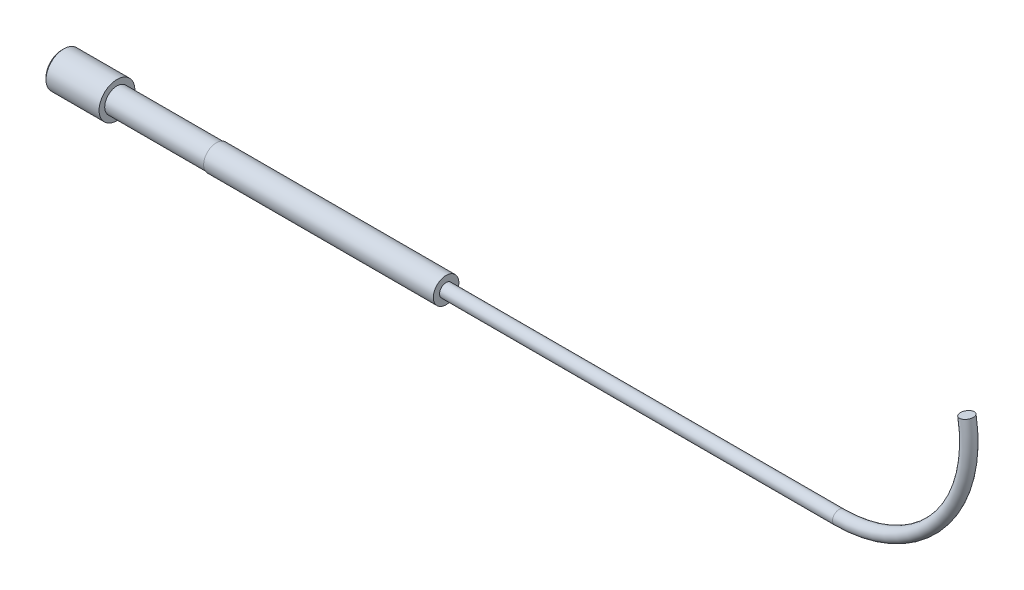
SolidWorks part; units mm, degrees
ref_plane "Front Plane" through (0, 0, 0) normal (0, 0, 1) x (1, 0, 0)
ref_plane "Top Plane" through (0, 0, 0) normal (0, 1, 0) x (1, 0, 0)
ref_plane "Right Plane" through (0, 0, 0) normal (1, 0, 0) x (0, 0, -1)
sketch "Sketch1" plane through (0, 0, 0) normal (0, 0, 1) x (1, 0, 0)
  line L0 (0, 0) -> (52.5031, 0) construction
  line L1 (0, 0) -> (0, 2.2225) construction
  line L2 (0, 2.2225) -> (6.858, 2.2225)
  line L3 (6.858, 2.2225) -> (6.858, 1.524)
  line L4 (6.858, 1.524) -> (19.2278, 1.524)
  line L5 (19.2278, 1.524) -> (19.2278, 1.5875)
  line L6 (19.2278, 1.5875) -> (47.8028, 1.5875)
  line L7 (47.8028, 1.5875) -> (47.8028, 0)
  line L8 (1.27, 0) -> (47.8028, 0)
  line L9 (0, 2.2225) -> (0, 1.651)
  line L10 (0, 1.651) -> (4.7625, 1.651)
  line L11 (4.7625, 1.651) -> (4.7625, 0.254)
  line L12 (4.7625, 0.254) -> (1.27, 0.254)
  line L13 (1.27, 0.254) -> (1.27, 0)
  dimension "D1" = 4.445
  dimension "D2" = 6.858
  dimension "D3" = 19.2278
  dimension "D4" = 28.575
  dimension "D5" = 3.175
  dimension "D6" = 3.048
  dimension "D7" = 4.7625
  dimension "D8" = 1.27
  dimension "D9" = 0.508
  dimension "D10" = 3.302
revolve "Revolve1" add sketch "Sketch1" angle 360 about L0
sketch "Sketch2" plane through (47.8028, 0, 0) normal (1, 0, 0) x (0, 0, -1)
  circle A0 centre (0, 0) radius 0.8128
  dimension "D1" = 1.6256
sketch3d "3DSketch1"
  line L0 (47.8028, 0, 0) -> (96.6831, 0, 0)
  arc A0 (96.6831, 0, 0) -> (112.5833, 18.936, 0) centre (96.6831, 16.1435, 0) ccw
  point P4 (96.6831, 16.1435, 16.1435)
sweep "Sweep1" add profiles "Sketch2" path "3DSketch1"
chamfer "Chamfer1" distance 0.254 angle 45 1 edges at (0, 0, 2.2225)
